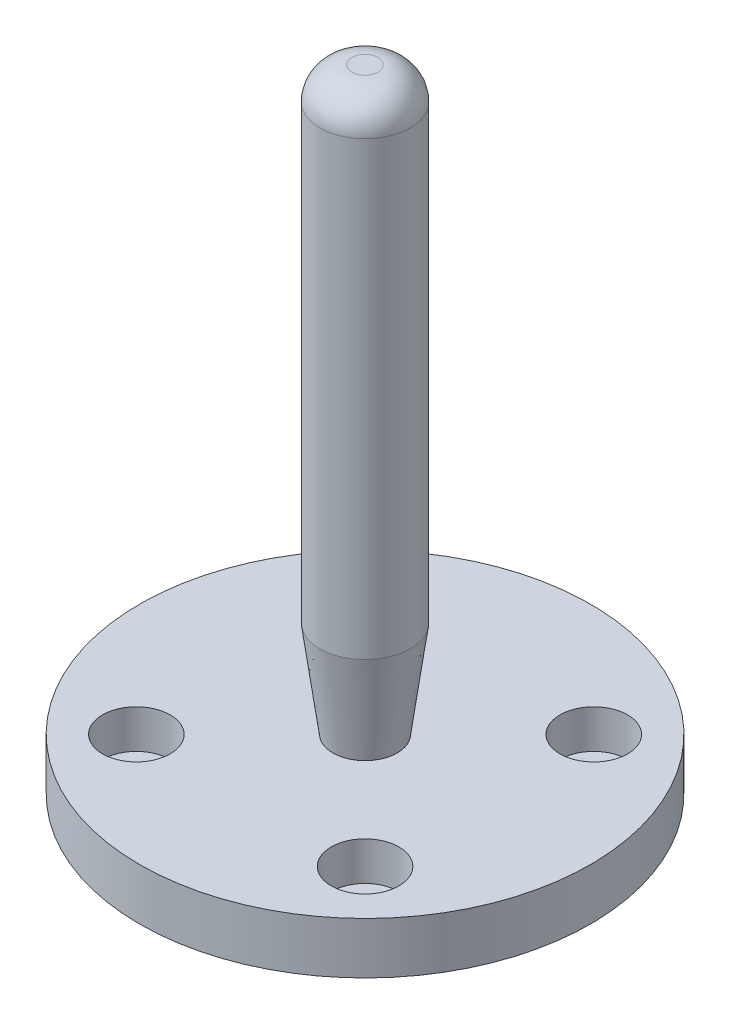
SolidWorks part; units mm, degrees
ref_plane "Front Plane" through (0, 0, 0) normal (0, 0, 1) x (1, 0, 0)
ref_plane "Top Plane" through (0, 0, 0) normal (0, 1, 0) x (1, 0, 0)
ref_plane "Right Plane" through (0, 0, 0) normal (1, 0, 0) x (0, 0, -1)
sketch "Sketch1" plane through (0, 0, 0) normal (0, 1, 0) x (1, 0, 0)
  circle A0 centre (0, 0) radius 35
  dimension "D1" = 70
extrude "Boss-Extrude1" add sketch "Sketch1" along normal blind 8
sketch "Sketch2" plane through (0, 8, 0) normal (0, 1, 0) x (1, 0, 0)
  circle A0 centre (-17.75, 17.75) radius 5.25
  circle A1 centre (17.75, 17.75) radius 5.25
  circle A2 centre (17.75, -17.75) radius 5.25
  circle A3 centre (-17.75, -17.75) radius 5.25
extrude "Cut-Extrude1" cut sketch "Sketch2" against normal blind 6
sketch "Sketch3" plane through (0, 2, 0) normal (0, 1, 0) x (1, 0, 0)
  circle A0 centre (17.75, 17.75) radius 3.25
  circle A1 centre (-17.75, 17.75) radius 3.25
  circle A2 centre (-17.75, -17.75) radius 3.25
  circle A3 centre (17.75, -17.75) radius 3.25
  dimension "D1" = 6.5
extrude "Cut-Extrude2" cut sketch "Sketch3" against normal blind 2
sketch "Sketch4" plane through (0, 0, 0) normal (1, 0, 0) x (0, 0, -1)
  line L0 (0, 8) -> (0, 98)
  line L1 (35, 8) -> (-35, 8) construction
  line L2 (0, 98) -> (7, 98)
  line L3 (7, 98) -> (7, 23)
  line L4 (7, 23) -> (5, 8)
  line L5 (5, 8) -> (0, 8)
  line L6 (23, 8) -> (12.5, 8) construction
  dimension "D1" = 5
  dimension "D2" = 7
  dimension "D3" = 15
  dimension "D4" = 90
revolve "Revolve1" add sketch "Sketch4" angle 360 about L0
fillet "Fillet2" radius 5 1 edges at (0, 98, -7)
equation "\"D5@Sketch2\"=\"D4@Sketch2\"/2"
equation "\"D3@Sketch2\"=\"D2@Sketch2\"/2"
equation "\"D9@Sketch2\"=\"D8@Sketch2\"/2"
equation "\"D7@Sketch2\"=\"D6@Sketch2\"/2"
